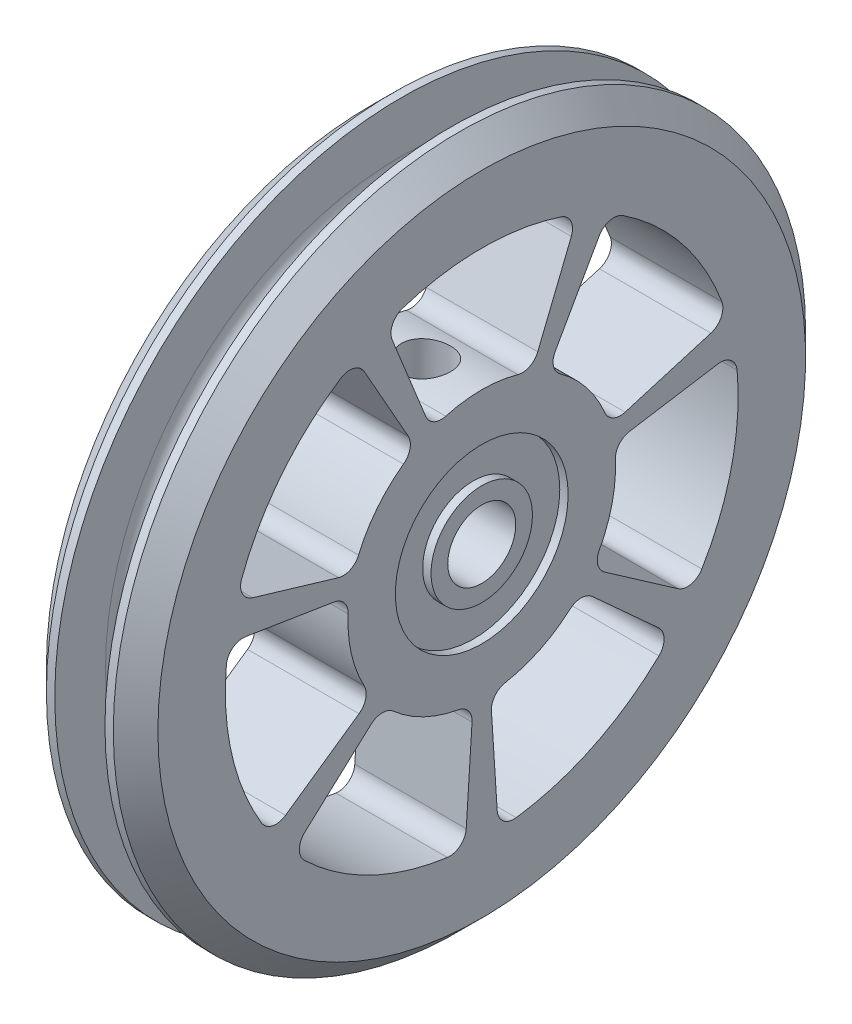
SolidWorks part; units mm, degrees
ref_plane "Plan de face" through (0, 0, 0) normal (0, 0, 1) x (1, 0, 0)
ref_plane "Plan de dessus" through (0, 0, 0) normal (0, 1, 0) x (1, 0, 0)
ref_plane "Plan de droite" through (0, 0, 0) normal (1, 0, 0) x (0, 0, -1)
sketch "Esquisse1" plane through (0, 0, 0) normal (0, 0, 1) x (1, 0, 0)
  line L0 (-19.0828, 0) -> (25.7633, 0) construction
  line L1 (0, 3.05) -> (0, -17.9547) construction
  line L2 (3, 31.05) -> (5, 29.05)
  line L3 (2.25, 31.05) -> (3, 31.05)
  line L4 (-2.25, 31.05) -> (-2.25, 26.5)
  line L5 (-5, 3.05) -> (5, 3.05)
  line L6 (5, 29.05) -> (5, 3.05)
  line L7 (-5, 29.05) -> (-5, 3.05)
  line L8 (-2.25, 31.05) -> (-3, 31.05)
  line L9 (-0.75, 25) -> (0.75, 25)
  line L10 (2.25, 31.05) -> (2.25, 26.5)
  line L11 (-3, 31.05) -> (-5, 29.05)
  line L12 (-2.25, 27.5) -> (2.25, 27.5) construction
  line L13 (-3.8958, 26) -> (4.0274, 26) construction
  line L14 (-2.25, -27.5) -> (2.25, -27.5) construction
  arc A0 (0.75, 25) -> (2.25, 26.5) centre (0.75, 26.5) ccw
  arc A1 (-0.75, 25) -> (-2.25, 26.5) centre (-0.75, 26.5) cw
  point P8 (5, 31.05)
  point P14 (2.25, 25)
  point P19 (0, 25)
  point P23 (-5, 31.05)
  dimension "D6" = 1.5
  dimension "D1" = 10
  dimension "D2" = 6.05
  dimension "D3" = 6.1
  dimension "D4" = 4.5
  dimension "D5" = 50
  dimension "D7" = 1
  dimension "D8" = 1.5
  dimension "D10" = 55
revolve "Révolution1" add sketch "Esquisse1" angle 360 about L0
sketch "Esquisse7" plane through (-5, 0, 0) normal (-1, 0, 0) x (0, 0, 1)
  line L0 (-5.0259, 12.4395) -> (-8.0344, 19.8859)
  line L1 (0, 12) -> (0, 25) construction
  line L2 (5.0259, 12.4395) -> (8.0344, 19.8859)
  line L3 (6.592, 11.6853) -> (10.538, 18.6802)
  line L4 (12.8592, 3.8265) -> (20.5568, 6.1171)
  line L5 (9.382, 7.4819) -> (19.5458, 15.5872) construction
  line L6 (13.246, 2.1318) -> (21.1751, 3.408)
  line L7 (11.0092, -7.6679) -> (17.5995, -12.258)
  line L8 (11.6991, -2.6703) -> (24.3732, -5.563) construction
  line L9 (9.9254, -9.0269) -> (15.8669, -14.4306)
  line L10 (0.8691, -13.3882) -> (1.3894, -21.4026)
  line L11 (5.2066, -10.8116) -> (10.8471, -22.5242) construction
  line L12 (-0.8691, -13.3882) -> (-1.3894, -21.4026)
  line L13 (-9.9254, -9.0269) -> (-15.8669, -14.4306)
  line L14 (-5.2066, -10.8116) -> (-10.8471, -22.5242) construction
  line L15 (-11.0092, -7.6679) -> (-17.5995, -12.258)
  line L16 (-13.246, 2.1318) -> (-21.1751, 3.408)
  line L17 (-11.6991, -2.6703) -> (-24.3732, -5.563) construction
  line L18 (-12.8592, 3.8265) -> (-20.5568, 6.1171)
  line L19 (-6.592, 11.6853) -> (-10.538, 18.6802)
  line L20 (-9.382, 7.4819) -> (-19.5458, 15.5872) construction
  arc A0 (-5.0259, 12.4395) -> (-3.2312, 11.5568) centre (-3.6351, 13.0014) ccw
  arc A1 (5.0259, 12.4395) -> (3.2312, 11.5568) centre (3.6351, 13.0014) cw
  circle A2 centre (0, 0) radius 23
  arc A3 (7.1072, 21.8744) -> (-7.1072, 21.8744) centre (0, 0) ccw
  circle A4 centre (0, 0) radius 25 construction
  arc A6 (3.2312, 11.5568) -> (-3.2312, 11.5568) centre (0, 0) ccw
  arc A7 (8.0344, 19.8859) -> (7.1072, 21.8744) centre (6.6436, 20.4478) ccw
  arc A8 (-8.0344, 19.8859) -> (-7.1072, 21.8744) centre (-6.6436, 20.4478) cw
  arc A9 (6.592, 11.6853) -> (7.0208, 9.7318) centre (7.8984, 10.9483) ccw
  arc A10 (12.8592, 3.8265) -> (11.0501, 4.6793) centre (12.4313, 5.2642) cw
  arc A11 (21.5333, 8.0819) -> (12.6708, 19.195) centre (0, 0) ccw
  arc A12 (11.0501, 4.6793) -> (7.0208, 9.7318) centre (0, 0) ccw
  arc A13 (20.5568, 6.1171) -> (21.5333, 8.0819) centre (20.129, 7.5548) ccw
  arc A14 (10.538, 18.6802) -> (12.6708, 19.195) centre (11.8445, 17.9432) cw
  arc A15 (13.246, 2.1318) -> (11.986, 0.5786) centre (13.4843, 0.6509) ccw
  arc A16 (11.0092, -7.6679) -> (10.548, -5.7218) centre (11.8665, -6.437) cw
  arc A17 (19.7445, -11.7965) -> (22.9074, 2.0615) centre (0, 0) ccw
  arc A18 (10.548, -5.7218) -> (11.986, 0.5786) centre (0, 0) ccw
  arc A19 (17.5995, -12.258) -> (19.7445, -11.7965) centre (18.4568, -11.0271) ccw
  arc A20 (21.1751, 3.408) -> (22.9074, 2.0615) centre (21.4135, 1.927) cw
  arc A21 (9.9254, -9.0269) -> (7.9255, -9.0103) centre (8.9162, -10.1366) ccw
  arc A22 (0.8691, -13.3882) -> (2.1031, -11.8143) centre (2.366, -13.2911) cw
  arc A23 (3.0876, -22.7918) -> (15.8943, -16.6245) centre (0, 0) ccw
  arc A24 (2.1031, -11.8143) -> (7.9255, -9.0103) centre (0, 0) ccw
  arc A25 (1.3894, -21.4026) -> (3.0876, -22.7918) centre (2.8862, -21.3054) ccw
  arc A26 (15.8669, -14.4306) -> (15.8943, -16.6245) centre (14.8577, -15.5403) cw
  arc A27 (-0.8691, -13.3882) -> (-2.1031, -11.8143) centre (-2.366, -13.2911) ccw
  arc A28 (-9.9254, -9.0269) -> (-7.9255, -9.0103) centre (-8.9162, -10.1366) cw
  arc A29 (-15.8943, -16.6245) -> (-3.0876, -22.7918) centre (0, 0) ccw
  arc A30 (-7.9255, -9.0103) -> (-2.1031, -11.8143) centre (0, 0) ccw
  arc A31 (-15.8669, -14.4306) -> (-15.8943, -16.6245) centre (-14.8577, -15.5403) ccw
  arc A32 (-1.3894, -21.4026) -> (-3.0876, -22.7918) centre (-2.8862, -21.3054) cw
  arc A33 (-11.0092, -7.6679) -> (-10.548, -5.7218) centre (-11.8665, -6.437) ccw
  arc A34 (-13.246, 2.1318) -> (-11.986, 0.5786) centre (-13.4843, 0.6509) cw
  arc A35 (-22.9074, 2.0615) -> (-19.7445, -11.7965) centre (0, 0) ccw
  arc A36 (-11.986, 0.5786) -> (-10.548, -5.7218) centre (0, 0) ccw
  arc A37 (-21.1751, 3.408) -> (-22.9074, 2.0615) centre (-21.4135, 1.927) ccw
  arc A38 (-17.5995, -12.258) -> (-19.7445, -11.7965) centre (-18.4568, -11.0271) cw
  arc A39 (-12.8592, 3.8265) -> (-11.0501, 4.6793) centre (-12.4313, 5.2642) ccw
  arc A40 (-6.592, 11.6853) -> (-7.0208, 9.7318) centre (-7.8984, 10.9483) cw
  arc A41 (-12.6708, 19.195) -> (-21.5333, 8.0819) centre (0, 0) ccw
  arc A42 (-7.0208, 9.7318) -> (-11.0501, 4.6793) centre (0, 0) ccw
  arc A43 (-10.538, 18.6802) -> (-12.6708, 19.195) centre (-11.8445, 17.9432) ccw
  arc A44 (-20.5568, 6.1171) -> (-21.5333, 8.0819) centre (-20.129, 7.5548) cw
  point P22 (8.616, 21.3252)
  point P25 (-8.616, 21.3252)
  point P110 (0, 0)
  dimension "D4" = 1.5
  dimension "D2" = 12
  dimension "D3" = 44
  dimension "D1" = 2
  dimension "D5" = 7
extrude "Enlèv. mat.-Extru.2" cut sketch "Esquisse7" against normal through all
hole_wizard "Diamètre du perçage Ø4.4 (4.4)1" positions "Esquisse8" profile "Esquisse9" hole size "Ø4.4" standard "ISO"
sketch "Esquisse8" plane through (0, 0, 0) normal (0, 1, 0) x (1, 0, 0)
  point P2 (0, 0)
sketch "Esquisse9" plane through (0, 0, 0) normal (1, 0, 0) x (0, 0, -1)
  line L0 (0, 0) -> (0, 12)
  line L1 (0, 12) -> (2.2, 12)
  line L2 (2.2, 12) -> (2.2, 0)
  line L5 (2.2, 0) -> (0, 0)
  line L11 (0, -6.35) -> (0, 107.95) construction
  dimension "Diamètre du perçage jusqu'au prochain" = 4.4
  dimension "Profondeur du perçage jusqu'au prochain" = 12
ref_plane "Plan1" through (0, 19.8859, 0) normal (0, 1, 0) x (1, 0, 0)
sketch "Esquisse10" plane through (0, 19.8859, 0) normal (0, 1, 0) x (1, 0, 0)
  circle A0 centre (0, 0) radius 1.5
  dimension "D1" = 3
extrude "Enlèv. mat.-Extru.3" cut sketch "Esquisse10" along normal blind 22
sketch "Esquisse11" plane through (5, 0, 0) normal (1, 0, 0) x (0, 0, -1)
  circle A0 centre (0, 0) radius 4.55
  circle A1 centre (0, 0) radius 7.75
  dimension "D1" = 9.1
  dimension "D2" = 15.5
extrude "Enlèv. mat.-Extru.4" cut sketch "Esquisse11" against normal blind 0.75
mirror "Symétrie1" about plane through (0, 0, 0) normal (1, 0, 0) of "Enlèv. mat.-Extru.4"
